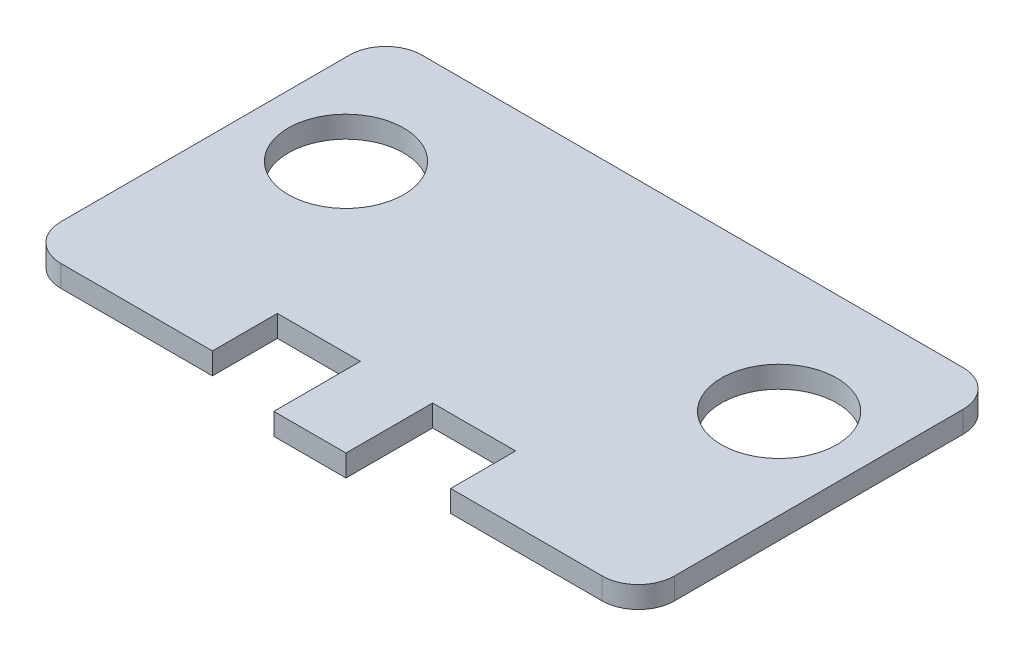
SolidWorks part; units mm, degrees
ref_plane "Front Plane" through (0, 0, 0) normal (0, 0, 1) x (1, 0, 0)
ref_plane "Top Plane" through (0, 0, 0) normal (0, 1, 0) x (1, 0, 0)
ref_plane "Right Plane" through (0, 0, 0) normal (1, 0, 0) x (0, 0, -1)
sketch "Sketch1" plane through (0, 0, 0) normal (0, 1, 0) x (1, 0, 0)
  line L1 (-42.5, 25) -> (42.5, 25)
  line L2 (-42.5, 25) -> (-42.5, -25)
  line L3 (-42.5, -25) -> (42.5, -25)
  line L4 (42.5, 25) -> (42.5, -25)
  line L5 (-42.5, 25) -> (42.5, -25) construction
  line L6 (-42.5, -25) -> (42.5, 25) construction
  point P0 (0, 0)
  dimension "D1" = 85
  dimension "D2" = 50
extrude "Boss-Extrude1" add sketch "Sketch1" along normal blind 3
fillet "Fillet1" radius 5 4 edges at (-42.5, 1.5, -25) (42.5, 1.5, -25) (42.5, 1.5, 25) (-42.5, 1.5, 25)
sketch "Sketch2" plane through (0, 3, 0) normal (0, 1, 0) x (1, 0, 0)
  line L1 (-30, 7) -> (30, 7) construction
  line L2 (37.5, 25) -> (-37.5, 25) construction
  line L3 (0, -1.65) -> (0, 1.65) construction
  circle A0 centre (-30, 7) radius 8
  circle A1 centre (30, 7) radius 8
  dimension "D4" = 16
  dimension "D1" = 18
  dimension "D2" = 30
  dimension "D3" = 30
extrude "Cut-Extrude1" cut sketch "Sketch2" against normal blind 3
sketch "Sketch4" plane through (0, 3, 0) normal (0, 1, 0) x (1, 0, 0)
  line L0 (-37.5, -25) -> (37.5, -25) construction
  line L1 (0, -25) -> (-16.5, -25)
  line L2 (0, -25) -> (0, -16)
  line L3 (0, -16) -> (-16.5, -16)
  line L4 (-16.5, -25) -> (-16.5, -16)
  dimension "D1" = 9
  dimension "D2" = 16.5
extrude "Cut-Extrude2" cut sketch "Sketch4" against normal blind 3
mirror "Mirror1" about plane through (0, 0, 0) normal (1, 0, 0) of "Cut-Extrude2"
sketch "Sketch6" plane through (0, 3, 0) normal (0, 1, 0) x (1, 0, 0)
  line L0 (16.5, -16) -> (-16.5, -16) construction
  line L1 (-5, -16) -> (5, -16)
  line L2 (-5, -16) -> (-5, -28)
  line L3 (-5, -28) -> (5, -28)
  line L4 (5, -16) -> (5, -28)
  line L5 (0, -1.65) -> (0, 1.65) construction
  dimension "D1" = 10
  dimension "D2" = 12
  dimension "D3" = 5
extrude "Boss-Extrude2" add sketch "Sketch6" against normal blind 3 contours L2 L3 L4 L1
